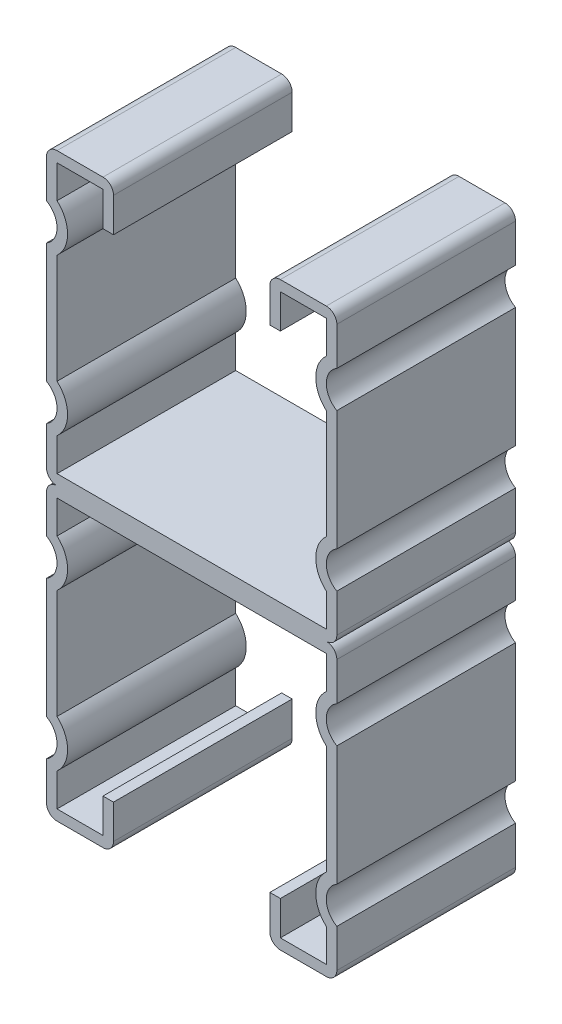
SolidWorks part; units mm, degrees
ref_plane "Plane1" through (0, 0, 0) normal (0, 0, 1) x (1, 0, 0)
ref_plane "Plane2" through (0, 0, 0) normal (0, 1, 0) x (1, 0, 0)
ref_plane "Plane3" through (0, 0, 0) normal (1, 0, 0) x (0, 0, -1)
sketch "Sketch1" plane through (0, 0, 0) normal (0, 0, 1) x (1, 0, 0)
  line L0 (-41.275, 39.7764) -> (-41.275, 34.3457)
  line L1 (-41.275, 29.1543) -> (-41.275, 12.1207)
  line L2 (-39.7764, 0) -> (-1.4986, 0)
  line L3 (0, 1.4986) -> (0, 6.9293)
  line L4 (0, 34.3457) -> (0, 39.7764)
  line L5 (-1.4986, 41.275) -> (-8.0264, 41.275)
  line L6 (-9.525, 39.7764) -> (-9.525, 34.925)
  line L7 (-39.7764, 41.275) -> (-33.2486, 41.275)
  line L8 (-31.75, 39.7764) -> (-31.75, 34.925)
  line L9 (-1.4986, 6.174) -> (-1.4986, 35.101) construction
  line L10 (-39.7764, 35.101) -> (-39.7764, 6.174) construction
  line L11 (-33.2486, 39.7764) -> (-33.2486, 34.925)
  line L12 (-39.7764, 39.7764) -> (-33.2486, 39.7764)
  line L13 (-39.7764, 39.7764) -> (-39.7764, 35.101)
  line L14 (-39.7764, 28.399) -> (-39.7764, 12.876)
  line L15 (-39.7764, 1.4986) -> (-1.4986, 1.4986)
  line L16 (-1.4986, 1.4986) -> (-1.4986, 6.174)
  line L17 (-1.4986, 35.101) -> (-1.4986, 39.7764)
  line L18 (-1.4986, 39.7764) -> (-8.0264, 39.7764)
  line L19 (-8.0264, 39.7764) -> (-8.0264, 34.925)
  line L20 (-33.2486, 34.925) -> (-31.75, 34.925)
  line L21 (-9.525, 34.925) -> (-8.0264, 34.925)
  line L22 (-10.16, 20.6375) -> (12.7, 20.6375) construction
  line L23 (-41.275, 6.9293) -> (-41.275, 1.4986)
  line L24 (-39.7764, 6.174) -> (-39.7764, 1.4986)
  line L25 (0, 12.1207) -> (0, 29.1543)
  line L26 (-1.4986, 12.876) -> (-1.4986, 28.399)
  arc A0 (0, 34.3457) -> (0, 29.1543) centre (1.4986, 31.75) ccw
  arc A1 (-41.275, 29.1543) -> (-41.275, 34.3457) centre (-42.7736, 31.75) ccw
  arc A2 (-33.2486, 41.275) -> (-31.75, 39.7764) centre (-33.2486, 39.7764) cw
  arc A3 (-41.275, 39.7764) -> (-39.7764, 41.275) centre (-39.7764, 39.7764) cw
  arc A4 (-39.7764, 0) -> (-41.275, 1.4986) centre (-39.7764, 1.4986) cw
  arc A5 (0, 1.4986) -> (-1.4986, 0) centre (-1.4986, 1.4986) cw
  arc A6 (-1.4986, 41.275) -> (0, 39.7764) centre (-1.4986, 39.7764) cw
  arc A7 (-9.525, 39.7764) -> (-8.0264, 41.275) centre (-8.0264, 39.7764) cw
  arc A8 (-39.7764, 28.399) -> (-39.7764, 35.101) centre (-42.7736, 31.75) ccw
  arc A9 (-1.4986, 35.101) -> (-1.4986, 28.399) centre (1.4986, 31.75) ccw
  arc A10 (0, 6.9293) -> (0, 12.1207) centre (1.4986, 9.525) cw
  arc A11 (-1.4986, 6.174) -> (-1.4986, 12.876) centre (1.4986, 9.525) cw
  arc A12 (-39.7764, 12.876) -> (-39.7764, 6.174) centre (-42.7736, 9.525) cw
  arc A13 (-41.275, 12.1207) -> (-41.275, 6.9293) centre (-42.7736, 9.525) cw
  dimension "D1" = 41.275
  dimension "D9" = 2.9972
  dimension "D10" = 2.9972
  dimension "D2" = 9.525
  dimension "D3" = 20.6375
  dimension "Width" = 41.275
  dimension "D6" = 22.225
  dimension "edge" = 9.525
  dimension "Lip" = 6.35
  dimension "gauge" = 1.4986
extrude "Base-Extrude" add sketch "Sketch1" along normal mid plane 25.4
mirror "Mirror1" about plane through (0, 0, 0) normal (0, 1, 0) of "Base-Extrude"
equation "\"D6@Sketch1\" = \"Width@Sketch1\" - 2 * \"edge@Sketch1\""
equation "\"D10@Sketch1\" = 2 * \"gauge@Sketch1\""
equation "\"D9@Sketch1\" = \"D10@Sketch1\""
equation "\"D2@Sketch1\" = \"edge@Sketch1\""
